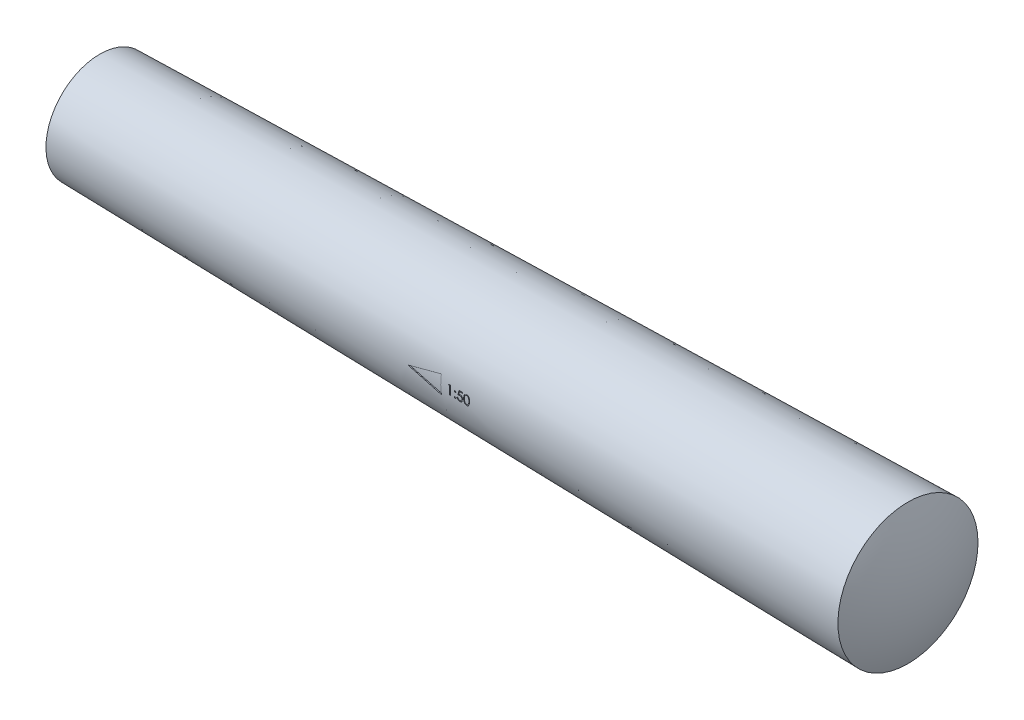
SolidWorks part; units mm, degrees
ref_plane "Front Plane" through (0, 0, 0) normal (0, 0, 1) x (1, 0, 0)
ref_plane "Top Plane" through (0, 0, 0) normal (0, 1, 0) x (1, 0, 0)
ref_plane "Right Plane" through (0, 0, 0) normal (1, 0, 0) x (0, 0, -1)
sketch "Sketch1" plane through (0, 0, 0) normal (1, 0, 0) x (0, 0, -1)
  circle A0 centre (0, 0) radius 6
  dimension "D1" = 12
extrude "Extrude1" add sketch "Sketch1" along normal mid plane 90
draft "Draft1" type of draft neutral plane draft angle 1.146 faces to draft 1 parameters "D1"=1.146
sketch "Sketch2" plane through (0, 0, 0) normal (0, 0, 1) x (1, 0, 0)
  line L0 (-45, 0) -> (-45, 6)
  line L1 (-45, 6) -> (-45, -6) construction
  line L2 (-45, 0) -> (-46.6, 0)
  line L3 (-46.6, 0) -> (-46.6, -6.9) construction
  line L4 (45, 0) -> (45, 7.8001)
  line L5 (45, -7.8001) -> (45, 7.8001) construction
  line L6 (45, 0) -> (46.6, 0)
  line L7 (46.6, 0) -> (46.6, -6.9) construction
  line L8 (-45, -6) -> (45, -7.8001) construction
  arc A0 (-46.6, 0) -> (-45, 6) centre (-34.55, 0) cw
  arc A1 (46.6, 0) -> (45, 7.8001) centre (26.7872, 0) ccw
  point P14 (0, -6.9)
revolve "Revolve1" add sketch "Sketch2" angle 360 about L2
sketch "Sketch5" plane through (0, 0, 0) normal (0, 0, 1) x (1, 0, 0)
  line L0 (0, 6.9) -> (0, -6.9) construction
  line L1 (45, 7.8001) -> (-45, 6) construction
  line L2 (-45, -6) -> (45, -7.8001) construction
ref_plane "Plane2" through (0, 0, 0) normal (-0.02, 0, 0.9998) x (0.9998, 0, 0.02)
sketch "Sketch6" plane through (0, 0, 0) normal (-0.02, 0, 0.9998) x (0.9998, 0, 0.02)
  line L0 (0, 0) -> (0, 1)
  line L1 (0, 6.9) -> (0, -6.9) construction
  line L2 (0, 1) -> (-3.7321, 0)
  line L3 (-3.7321, 0) -> (0, -1)
  line L4 (0, -1) -> (0, 0)
  line L5 (0, -0.5) -> (4, -0.5) construction
  text T0 "1:50" font "Century Gothic" height 1
  dimension "D1" = 2
  dimension "D2" = 30
  dimension "D3" = 4
wrap "Wrap2" sketch "Sketch6" wrap type deboss source sketch "Sketch6" thickness 0.1 parameters "D1"=0.1
equation "\"D2@Sketch2\" = \"D1@Sketch2\""
